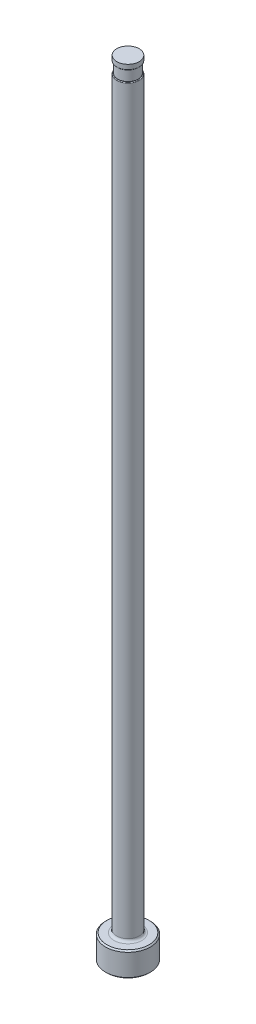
SolidWorks part; units mm, degrees
ref_plane "Front Plane" through (0, 0, 0) normal (0, 0, 1) x (1, 0, 0)
ref_plane "Top Plane" through (0, 0, 0) normal (0, 1, 0) x (1, 0, 0)
ref_plane "Right Plane" through (0, 0, 0) normal (1, 0, 0) x (0, 0, -1)
other "Configuration Table"
sketch "Sketch1" plane through (0, 0, 0) normal (0, 0, 1) x (1, 0, 0)
  line L0 (0, 259.9588) -> (0, -15.1925) construction
  line L1 (0, 0) -> (-4.3561, 0)
  line L2 (-4.3561, 0) -> (-4.3561, 4.7498)
  line L3 (-4.3561, 4.7498) -> (-2.1819, 4.7498)
  line L4 (-2.1819, 4.7498) -> (-2.1819, 152.4)
  line L5 (-2.1819, 152.4) -> (0, 152.4)
  line L6 (0, 152.4) -> (0, 0)
  dimension "L" = 152.4
  dimension "H" = 8.7122
  dimension "T" = 4.7498
  dimension "D" = 4.3637
revolve "Revolve1" add sketch "Sketch1" angle 360 about L0
chamfer "Chamfer1" distance 0.254 angle 45 2 edges at (0, 4.7498, 4.3561) (0, 0, 4.3561)
fillet "Fillet1" radius 0.508 1 edges at (0, 4.7498, 2.1819)
sketch "Sketch2" plane through (0, 0, 0) normal (0, 0, 1) x (1, 0, 0)
  line L0 (-2.1819, 152.4) -> (-2.1819, 5.2578) construction
  line L1 (-2.1819, 151.384) -> (-1.9787, 151.384)
  line L2 (-2.1819, 151.384) -> (-2.1819, 149.352)
  line L3 (-2.1819, 149.352) -> (-1.9787, 149.352)
  line L4 (-1.9787, 151.384) -> (-1.9787, 149.352)
  line L5 (2.1819, 152.4) -> (-2.1819, 152.4) construction
  line L6 (0, 153.4483) -> (0, 147.3282) construction
  dimension "D1" = 2.032
  dimension "N" = 1.016
  dimension "FD" = 0.2032
  dimension "D3" = 3.9573
revolve "Vent Relief" cut sketch "Sketch2" angle 360 about L6
sketch "Sketch3" plane through (0, 0, 0) normal (0, 0, 1) x (1, 0, 0)
  line L0 (-1.9787, 150.368) -> (-1.9787, 86.868)
  line L1 (-1.9787, 151.384) -> (-1.9787, 149.352) construction
  line L2 (-2.1819, 149.352) -> (-2.1819, 5.2578) construction
  line L3 (-2.1819, 85.7504) -> (-2.1819, 150.368)
  line L4 (-2.1819, 150.368) -> (-1.9787, 150.368)
  arc A0 (-1.9787, 86.868) -> (-2.1819, 85.7504) centre (-5.1537, 86.868) cw
  dimension "D1" = 3.175
  dimension "D2" = 63.5
extrude "D-Slot" cut sketch "Sketch3" against normal through all both and the other way through all
sketch "Sketch5" plane through (0, 0, 0) normal (0, 0, 1) x (1, 0, 0)
  line L0 (-2.1819, 151.384) -> (2.1819, 151.384) construction
  line L1 (-2.1819, 152.4) -> (-2.1768, 152.4)
  line L2 (-2.1819, 152.4) -> (-2.1819, 151.384)
  line L3 (-2.1819, 151.384) -> (-2.1768, 151.384)
  line L4 (-2.1768, 152.4) -> (-2.1768, 151.384)
  line L5 (0, 152.6877) -> (0, 150.5771) construction
  dimension "VP" = 0.0051
revolve "Vent Diameter" cut sketch "Sketch5" angle 360 about L5
fillet "Fillet2" radius 0.127 2 edges at (2.1819, 149.352, 0) (0, 151.384, 2.1768)
sketch "Pocket Sketch" plane through (0, 0, 0) normal (0, 0, 1) x (1, 0, 0)
  line L0 (-4.753, 0) -> (-4.753, 4.7752)
  line L1 (-4.753, 4.7752) -> (-3.1423, 4.7752)
  line L2 (-2.3803, 5.5372) -> (-2.3803, 22.225)
  line L3 (-2.3803, 22.225) -> (0, 22.225)
  line L4 (0, 22.225) -> (0, 0)
  line L5 (0, 0) -> (-4.753, 0)
  line L6 (0, 12.6104) -> (0, -2.4989) construction
  line L7 (-4.3561, 4.4958) -> (-4.3561, 0.254) construction
  line L8 (4.1021, 4.7498) -> (-4.1021, 4.7498) construction
  line L9 (-2.1819, 85.7504) -> (-2.1819, 5.2578) construction
  line L10 (-3.1423, 4.7752) -> (-2.3803, 5.5372)
  point P3 (-2.3803, 4.7752)
  dimension "D1" = 9.5059
  dimension "D2" = 0.3969
  dimension "D3" = 0.0254
  dimension "D4" = 0.1984
  dimension "D5" = 4.7606
  dimension "D6" = 22.225
